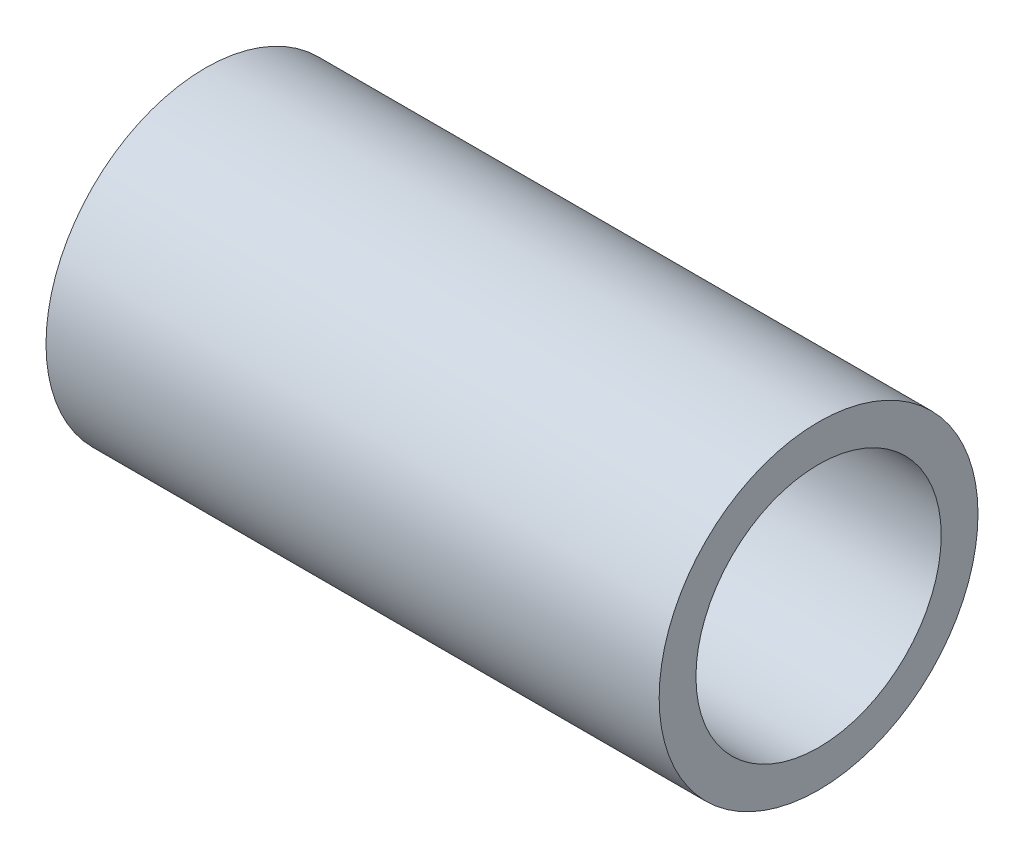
SolidWorks part; units mm, degrees
ref_plane "Front" through (0, 0, 0) normal (0, 0, 1) x (1, 0, 0)
ref_plane "Top" through (0, 0, 0) normal (0, 1, 0) x (1, 0, 0)
ref_plane "Right" through (0, 0, 0) normal (1, 0, 0) x (0, 0, -1)
sketch "Sketch1" plane through (0, 0, 0) normal (0, 0, 1) x (1, 0, 0)
  line L0 (0, 0) -> (63.5, 0)
  line L1 (9.9848, 0) -> (-9.9848, 0) construction
  dimension "D1" = 63.5
other "Structural Member1"
ref_plane "Plane1" through (0, 0, 0) normal (1, 0, 0) x (0, 0, -1)
sketch "Sketch11" plane through (0, 0, 0) normal (1, 0, 0) x (0, 0, -1)
  circle A0 centre (0, 0) radius 12.7
  circle A1 centre (0, 0) radius 16.51
  point P3 (0, 0)
  dimension "D1" = 33.02
  dimension "D2" = 25.4
